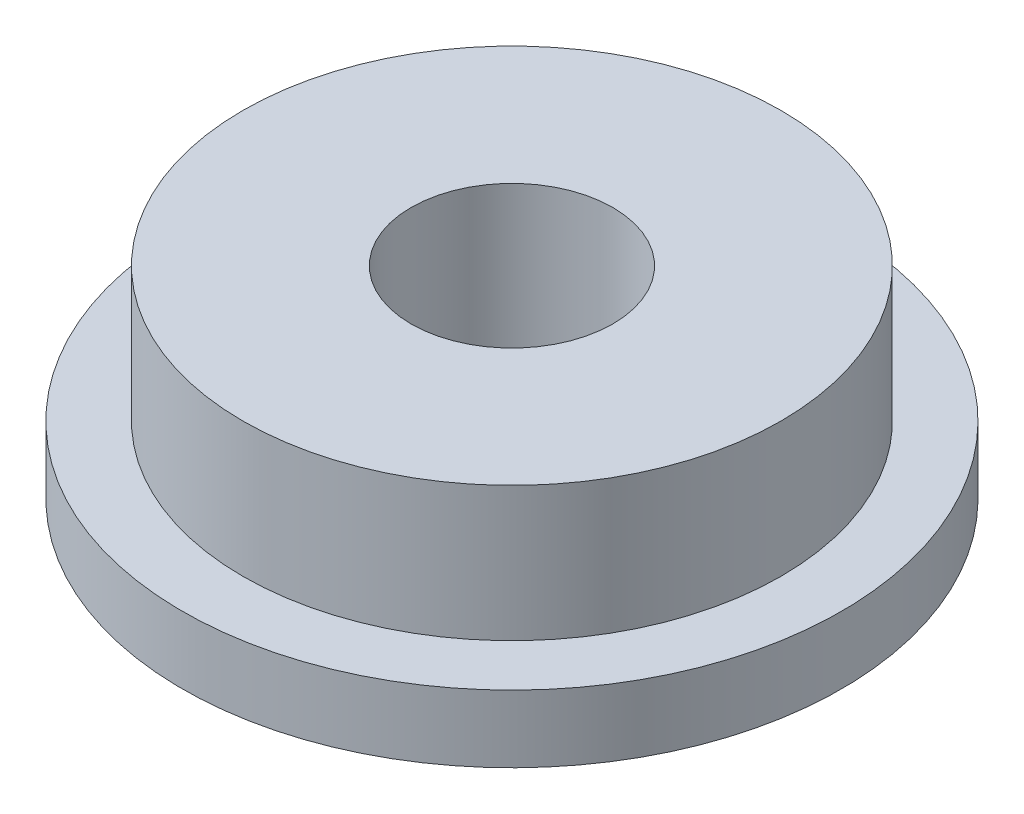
SolidWorks part; units mm, degrees
ref_plane "Front Plane" through (0, 0, 0) normal (0, 0, 1) x (1, 0, 0)
ref_plane "Top Plane" through (0, 0, 0) normal (0, 1, 0) x (1, 0, 0)
ref_plane "Right Plane" through (0, 0, 0) normal (1, 0, 0) x (0, 0, -1)
sketch "Sketch1" plane through (0, 0, 0) normal (0, 0, 1) x (1, 0, 0)
  line L0 (0, 25.2723) -> (0, -33.6422) construction
  line L1 (0, -55) -> (0, 55) construction
  line L2 (2, 0) -> (2.45, 0)
  line L3 (55, 0) -> (-55, 0) construction
  line L4 (2.45, 0) -> (2.45, -0.5)
  line L5 (2.45, -0.5) -> (0.75, -0.5)
  line L6 (0.75, -0.5) -> (0.75, 1)
  line L7 (0.75, 1) -> (2, 1)
  line L8 (2, 1) -> (2, 0)
  dimension "D1" = 1.5
  dimension "D2" = 4
  dimension "D3" = 1.5
  dimension "D4" = 0.5
  dimension "D5" = 4.9
revolve "Revolve1" add sketch "Sketch1" angle 360 about L0
